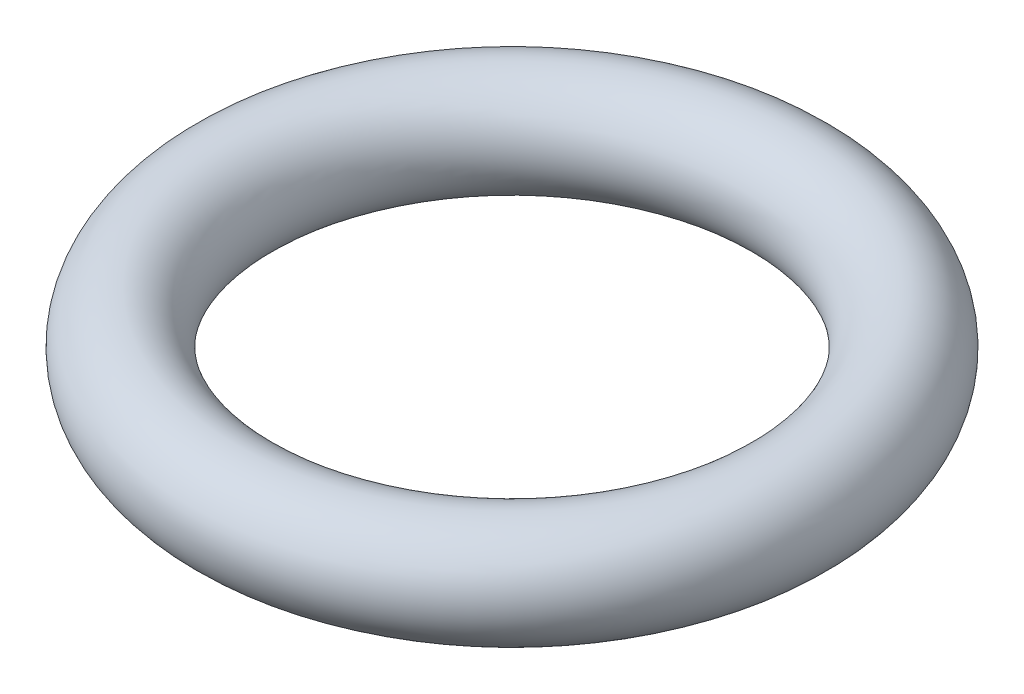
SolidWorks part; units mm, degrees
ref_plane "Front" through (0, 0, 0) normal (0, 0, 1) x (1, 0, 0)
ref_plane "Top" through (0, 0, 0) normal (0, 1, 0) x (1, 0, 0)
ref_plane "Right" through (0, 0, 0) normal (1, 0, 0) x (0, 0, -1)
sketch "Sketch1" plane through (0, 0, 0) normal (0, 0, 1) x (1, 0, 0)
  line L0 (0, 0.254) -> (0, -0.254) construction
  line L1 (0, -13.1913) -> (0, 12.1805) construction
  circle A0 centre (6.2706, 0) radius 1.1906
  dimension "WIDTH" = 2.3813
  dimension "OD" = 14.9225
  dimension "ID" = 10.16
revolve "BASE SHAPE" add sketch "Sketch1" angle 360 about L0
ref_point "Point1"
